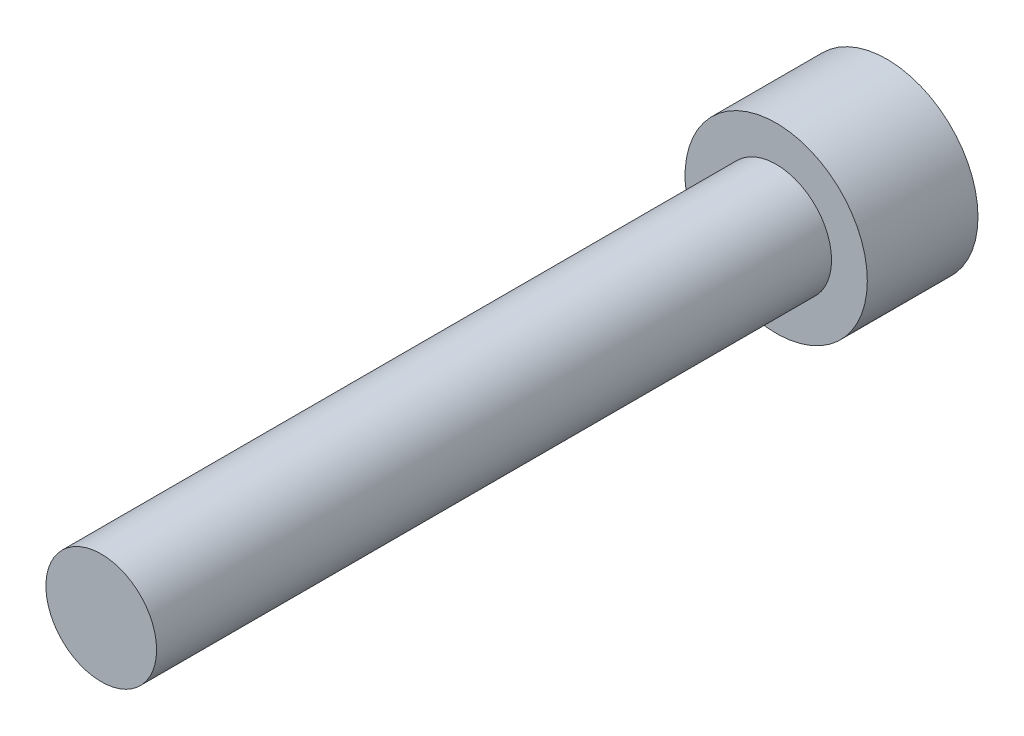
SolidWorks part; units mm, degrees
ref_plane "Front Plane" through (0, 0, 0) normal (0, 0, 1) x (1, 0, 0)
ref_plane "Top Plane" through (0, 0, 0) normal (0, 1, 0) x (1, 0, 0)
ref_plane "Right Plane" through (0, 0, 0) normal (1, 0, 0) x (0, 0, -1)
sketch "Sketch6" plane through (0, 0, 0) normal (1, 0, 0) x (0, 0, -1)
  line L0 (-25.4, 0) -> (22.525, 0) construction
  line L1 (3.7719, 0) -> (-3.7719, 0) construction
  line L2 (-25.4, 0) -> (-25.4, -2.0828)
  line L3 (-25.4, -2.0828) -> (0, -2.0828)
  line L4 (0, 3.7719) -> (0, -3.7719) construction
  line L5 (0, -2.0828) -> (0, -3.429)
  line L6 (0, -3.429) -> (4.1656, -3.429)
  line L7 (4.1656, -3.429) -> (4.1656, 0)
  line L8 (4.1656, 0) -> (-25.4, 0)
  dimension "L" = 25.4
  dimension "H" = 4.1656
  dimension "A" = 6.858
  dimension "D" = 4.1656
revolve "Revolve1" add sketch "Sketch6" angle 360 about L0
sketch "Sketch7" plane through (0, 0, -4.1656) normal (0, 0, -1) x (-1, 0, 0)
  line L2 (-1.778, 1.0265) -> (-1.778, -1.0265)
  line L4 (-1.778, -1.0265) -> (0, -2.0531)
  line L5 (0, -2.0531) -> (1.778, -1.0265)
  line L6 (1.778, -1.0265) -> (1.778, 1.0265)
  line L7 (1.778, 1.0265) -> (0, 2.0531)
  line L8 (0, 2.0531) -> (-1.778, 1.0265)
  circle A0 centre (0, 0) radius 1.778 construction
  dimension "J" = 3.556
extrude "HEX" cut sketch "Sketch7" against normal blind 2.794
